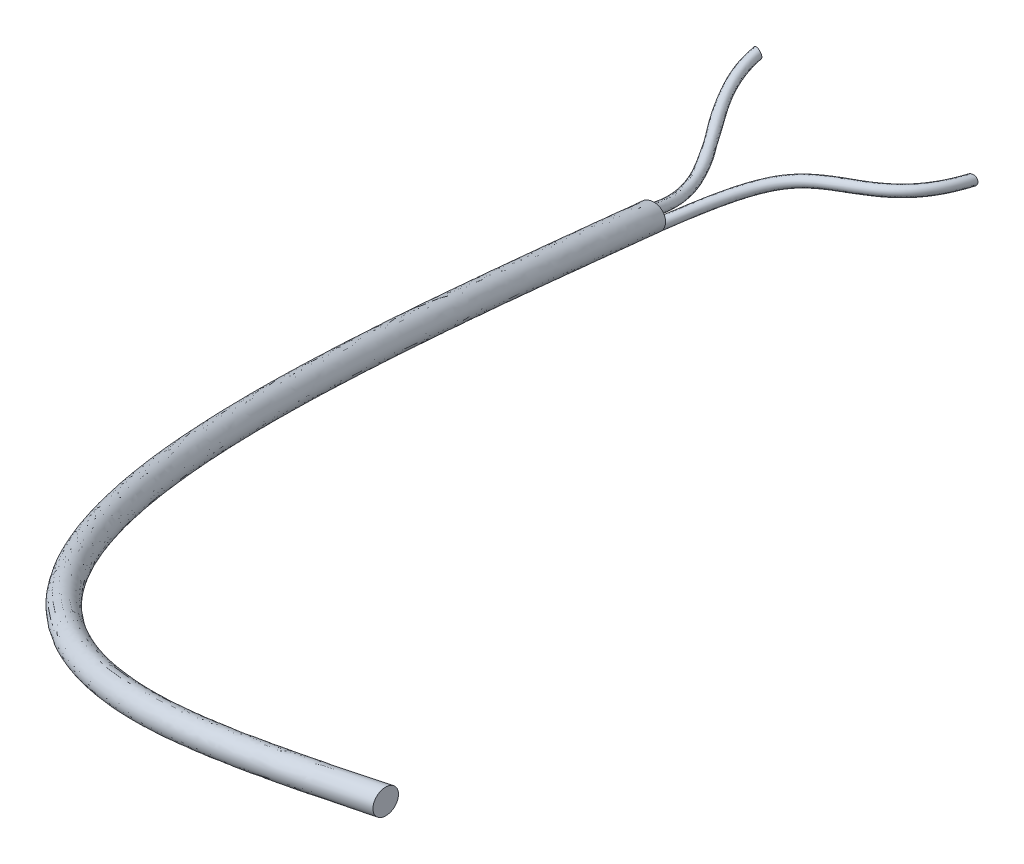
SolidWorks part; units mm, degrees
ref_plane "Plan de face" through (0, 0, 0) normal (0, 0, 1) x (1, 0, 0)
ref_plane "Plan de dessus" through (0, 0, 0) normal (0, 1, 0) x (1, 0, 0)
ref_plane "Plan de droite" through (0, 0, 0) normal (1, 0, 0) x (0, 0, -1)
sketch3d "Esquisse3D1"
  circle A0 centre (44.2809, 68.0792, 130.6641) radius 2 construction
  spline S0 degree 3 poles (44.2809, 68.0792, 130.6641) (31.5419, 66.1564, 131.5882) (-42.1122, 55.039, 136.9315) (-55.6423, 33.8444, 49.5936) (-66.8322, 16.3155, -22.6386) knots 0 0 0 0 0.172957 1 1 1 1
  point P8 (42.2813, 68.0967, 130.6339)
sketch "Esquisse1" plane through (45.6481, -0.3984, 0.69) normal (-0.9998, 0.0087, -0.0151) x (-0.0151, 0.0001, 0.9999)
  circle A0 centre (129.9889, 68.4631) radius 2
sweep "Balayage1" add profiles "Esquisse1" path "Esquisse3D1"
sketch "Esquisse2" plane through (-3.7188, -1.6983, -29.5469) normal (-0.1247, -0.0569, -0.9906) x (-0.9922, 0.0072, 0.1245)
  circle A0 centre (64.8108, 17.5877) radius 0.7989
  circle A1 centre (63.6097, 17.5877) radius 2 construction
sketch "Esquisse3" plane through (-3.7188, -1.6983, -29.5469) normal (-0.1247, -0.0569, -0.9906) x (-0.9922, 0.0072, 0.1245)
  circle A0 centre (62.6828, 16.8255) radius 0.8
  circle A2 centre (63.6097, 17.5877) radius 2 construction
  dimension "D1" = 1.6
sketch3d "Esquisse3D2"
  spline S0 degree 3 poles (-68.0239, 16.3241, -22.4891) (-69.0627, 10.8993, -38.0214) (-78.1208, 16.7801, -40.2673) (-79.167, 18.0056, -51.843) knots 0 0 0 0 1 1 1 1
sketch3d "Esquisse3D3"
  spline S0 degree 3 poles (-65.9126, 15.548, -22.7103) (-64.6678, 15.8921, -28.4866) (-61.3362, 16.8132, -43.946) (-46.5959, 19.4739, -39.0848) (-45.1753, 17.5365, -51.843) knots 0 0 0 0 0.373646 1 1 1 1
sweep "Balayage3" add profiles "Esquisse2" path "Esquisse3D2"
sweep "Balayage4" add profiles "Esquisse3" path "Esquisse3D3"
